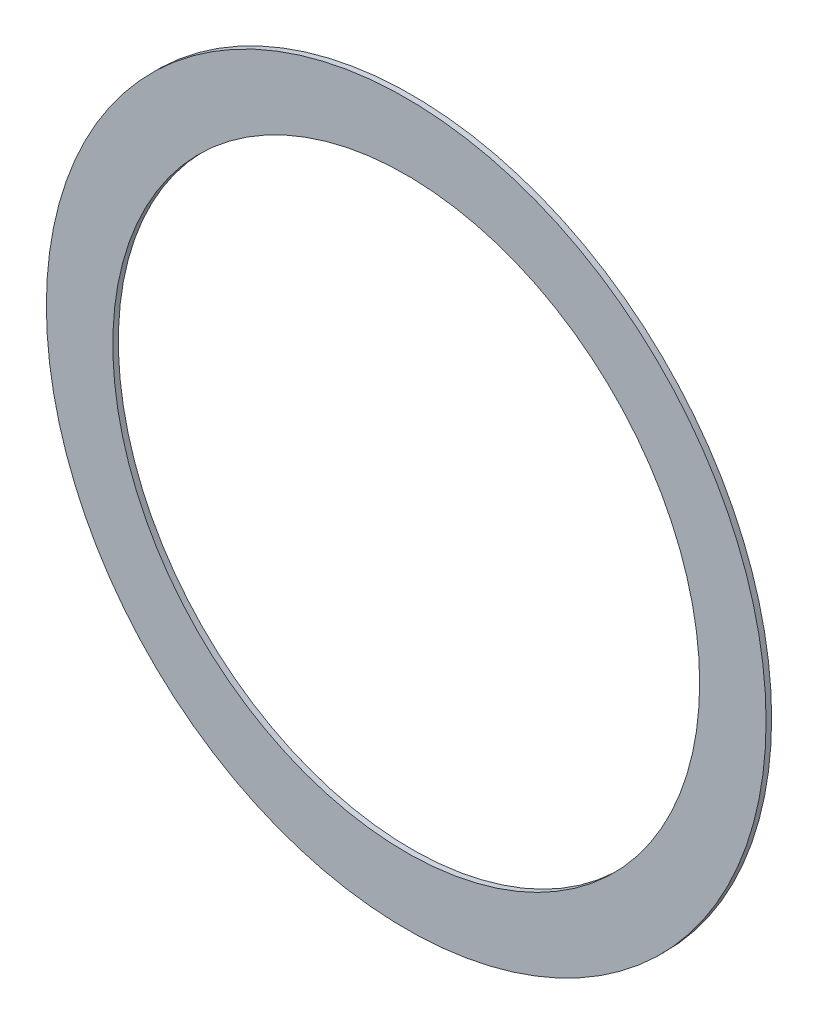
SolidWorks part; units mm, degrees
ref_plane "Front Plane" through (0, 0, 0) normal (0, 0, 1) x (1, 0, 0)
ref_plane "Top Plane" through (0, 0, 0) normal (0, 1, 0) x (1, 0, 0)
ref_plane "Right Plane" through (0, 0, 0) normal (1, 0, 0) x (0, 0, -1)
sketch "Sketch1" plane through (0, 0, 0) normal (0, 0, 1) x (1, 0, 0)
  circle A0 centre (0, 0) radius 168.275 construction
  circle A1 centre (0, 0) radius 206.375 construction
  circle A2 centre (0, 0) radius 168.275
  circle A3 centre (0, 0) radius 206.375
extrude "Extrude1" add sketch "Sketch1" along normal blind 3.175
